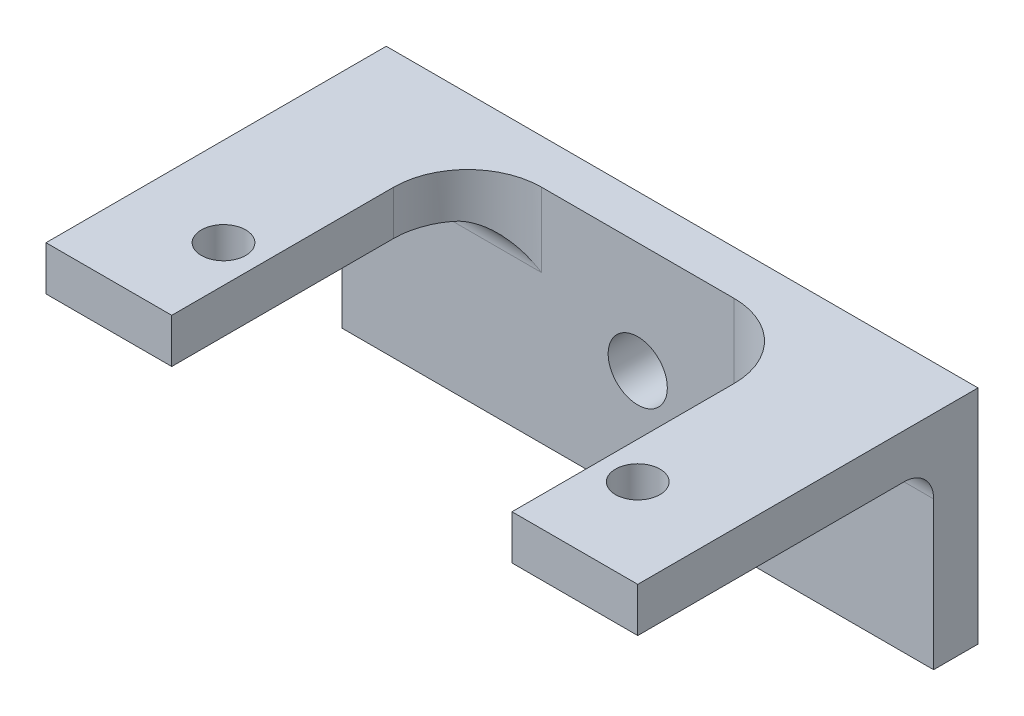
SolidWorks part; units mm, degrees
ref_plane "Plan de face" through (0, 0, 0) normal (0, 0, 1) x (1, 0, 0)
ref_plane "Plan de dessus" through (0, 0, 0) normal (0, 1, 0) x (1, 0, 0)
ref_plane "Plan de droite" through (0, 0, 0) normal (1, 0, 0) x (0, 0, -1)
sketch "Esquisse1" plane through (0, 0, 0) normal (0, 0, 1) x (1, 0, 0)
  line L1 (-40, 15) -> (0, 15)
  line L2 (-40, 15) -> (-40, 0)
  line L3 (-40, 0) -> (0, 0)
  line L4 (0, 15) -> (0, 0)
  circle A0 centre (-20, 7.5) radius 2
  point P4 (0, 0)
  point P7 (-20, 15)
  point P9 (0, 0)
  point P10 (-40, 7.5)
  dimension "D3" = 4
  dimension "D1" = 15
  dimension "D2" = 40
extrude "Boss.-Extru.1" add sketch "Esquisse1" along normal blind 3
sketch "Esquisse3" plane through (0, 0, 3) normal (0, 0, 1) x (1, 0, 0)
  line L0 (-20, 15) -> (-20, 0) construction
  line L1 (-40, 15) -> (-31.5, 15)
  line L2 (-40, 15) -> (-40, 12)
  line L3 (-40, 12) -> (-31.5, 12)
  line L4 (-31.5, 15) -> (-31.5, 12)
  line L5 (0, 15) -> (-40, 15) construction
  line L6 (-40, 0) -> (0, 0) construction
  line L7 (-8.5, 15) -> (-8.5, 12)
  line L8 (0, 12) -> (-8.5, 12)
  line L9 (0, 15) -> (0, 12)
  line L10 (0, 15) -> (-8.5, 15)
  dimension "D1" = 3
  dimension "D2" = 11.5
extrude "Boss.-Extru.2" add sketch "Esquisse3" along normal blind 20
sketch "Esquisse4" plane through (0, 15, 0) normal (0, 1, 0) x (1, 0, 0)
  line L0 (-20, -0.7718) -> (-20, -16.2654) construction
  line L2 (-31.5, -23) -> (-40, -23) construction
  circle A0 centre (-34, -17) radius 1.5
  circle A1 centre (-6, -17) radius 1.5
  dimension "D1" = 3
  dimension "D2" = 14
  dimension "D3" = 6
extrude "Enlèv. mat.-Extru.1" cut sketch "Esquisse4" against normal up to next
fillet "Congé1" radius 2 2 edges at (-4.25, 12, 3) (-35.75, 12, 3)
fillet "Congé2" radius 5 2 edges at (-8.5, 12.5, 3) (-31.5, 12.5, 3)
